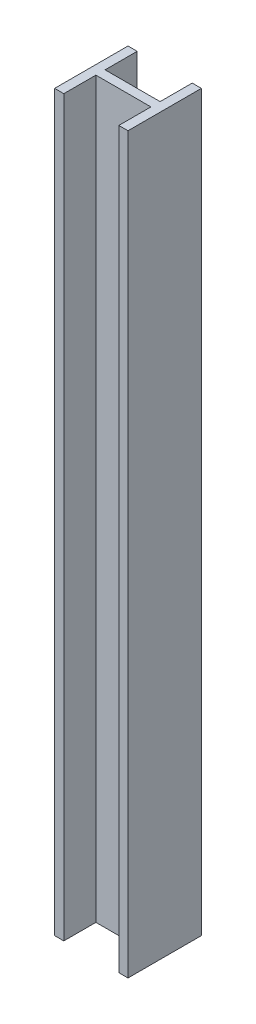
SolidWorks part; units mm, degrees
ref_plane "Front Plane" through (0, 0, 0) normal (0, 0, 1) x (1, 0, 0)
ref_plane "Top Plane" through (0, 0, 0) normal (0, 1, 0) x (1, 0, 0)
ref_plane "Right Plane" through (0, 0, 0) normal (1, 0, 0) x (0, 0, -1)
sketch "Sketch1" plane through (0, 0, 0) normal (0, 1, 0) x (1, 0, 0)
  line L0 (-19.05, 0) -> (19.05, 0)
  line L1 (19.05, 0) -> (19.05, 22.225)
  line L2 (19.05, 22.225) -> (25.4, 22.225)
  line L3 (25.4, 22.225) -> (25.4, -28.575)
  line L4 (25.4, -28.575) -> (19.05, -28.575)
  line L5 (19.05, -28.575) -> (19.05, -6.35)
  line L6 (19.05, -6.35) -> (-19.05, -6.35)
  line L7 (0, -6.35) -> (0, 0) construction
  line L8 (-19.05, -28.575) -> (-19.05, -6.35)
  line L9 (-25.4, -28.575) -> (-19.05, -28.575)
  line L10 (-25.4, 22.225) -> (-25.4, -28.575)
  line L11 (-19.05, 22.225) -> (-25.4, 22.225)
  line L12 (-19.05, 0) -> (-19.05, 22.225)
  dimension "D1" = 6.35
  dimension "D2" = 50.8
  dimension "D3" = 6.35
  dimension "D4" = 38.1
extrude "Boss-Extrude1" add sketch "Sketch1" along normal blind 508
